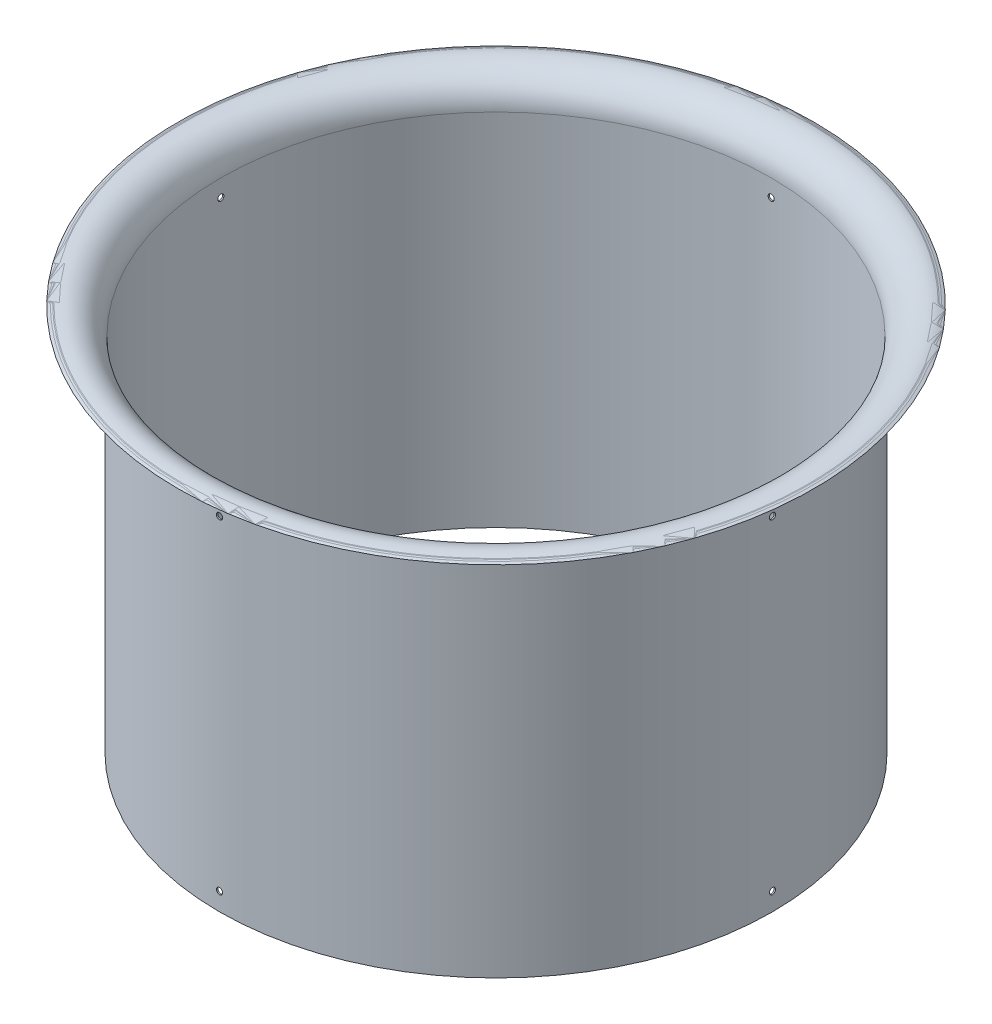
SolidWorks part; units mm, degrees
ref_plane "Front Plane" through (0, 0, 0) normal (0, 0, 1) x (1, 0, 0)
ref_plane "Top Plane" through (0, 0, 0) normal (0, 1, 0) x (1, 0, 0)
ref_plane "Right Plane" through (0, 0, 0) normal (1, 0, 0) x (0, 0, -1)
sketch "Sketch4" plane through (0, 0, 0) normal (0, 0, 1) x (1, 0, 0)
  line L0 (0, 0) -> (0, 227.7298) construction
  line L1 (-146.05, 0) -> (0, 0) construction
  line L2 (-146.05, 0) -> (-146.05, 190.5)
  line L3 (-145.3261, 0) -> (-145.3261, 190.0629)
  line L4 (-146.05, 0) -> (-145.3261, 0)
  arc A0 (-146.05, 190.5) -> (-167.8091, 204.3621) centre (-161.3451, 190.5) ccw
  arc A1 (-145.3261, 190.0629) -> (-167.8091, 204.3621) centre (-161.1147, 190.0629) ccw
  dimension "D1" = 146.05
  dimension "D2" = 190.5
  dimension "D3" = 0.7239
revolve "Revolve2" add sketch "Sketch4" angle 360 about L0
sketch "Sketch5" plane through (0, 0, 0) normal (0, 0, 1) x (1, 0, 0)
  line L0 (0, 0) -> (0, 9.525) construction
  line L3 (0, 180.975) -> (0, 190.5) construction
  line L4 (146.05, 190.5) -> (-146.05, 190.5) construction
  dimension "D1" = 9.525
  dimension "D2" = 9.525
hole_wizard "#4 Clearance Hole1" positions "Sketch7" profile "Sketch8" hole size "#4" standard "ANSI Inch"
sketch "Sketch7" plane through (0, 0, 0) normal (0, 0, 1) x (1, 0, 0)
  point P0 (0, 180.975)
  point P3 (0, 9.525)
sketch "Sketch8" plane through (0, 180.975, 0) normal (1, 0, 0) x (0, -1, 0)
  line L0 (0, 0) -> (0, 167.8091)
  line L1 (0, 167.8091) -> (1.6319, 167.8091)
  line L2 (1.6319, 167.8091) -> (1.6319, 0)
  line L5 (1.6319, 0) -> (0, 0)
  line L11 (0, -6.35) -> (0, 107.95) construction
  dimension "Thru Hole Dia." = 3.2639
  dimension "Thru Hole Depth" = 167.8091
pattern_circular "CirPattern1" count 4 over 360 about axis through (0, 0, 0) along (0, -1, 0) of "#4 Clearance Hole1"
